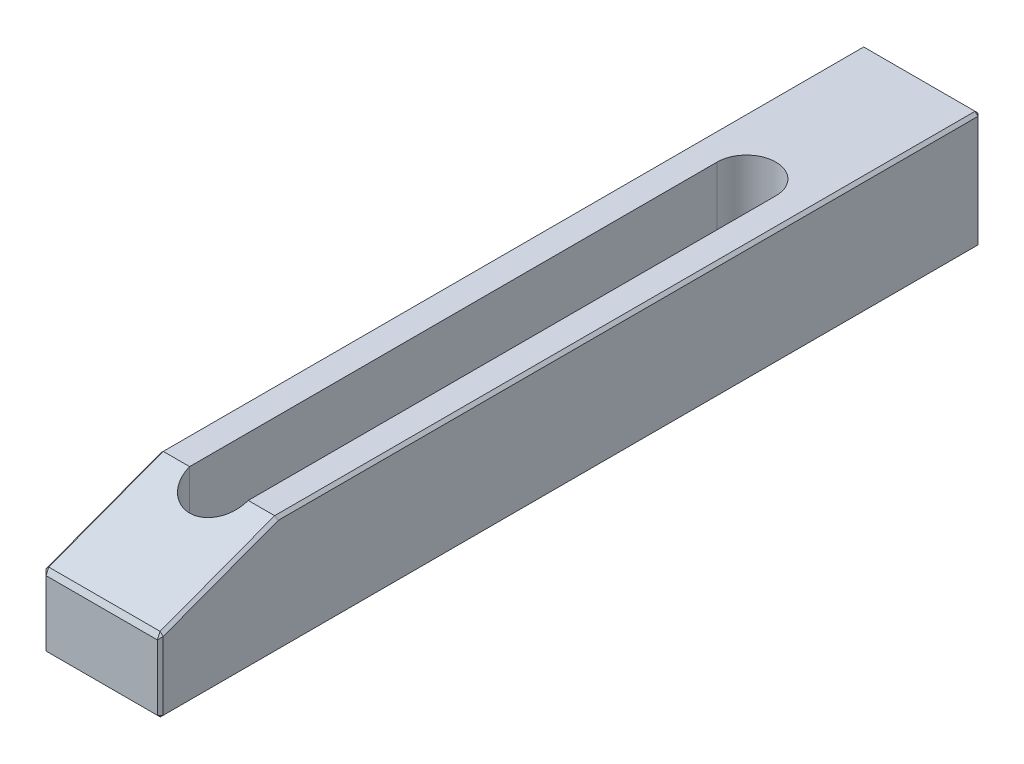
SolidWorks part; units mm, degrees
ref_plane "Plan de face" through (0, 0, 0) normal (0, 0, 1) x (1, 0, 0)
ref_plane "Plan de dessus" through (0, 0, 0) normal (0, 1, 0) x (1, 0, 0)
ref_plane "Plan de droite" through (0, 0, 0) normal (1, 0, 0) x (0, 0, -1)
sketch "Esquisse1" plane through (0, 0, 0) normal (1, 0, 0) x (0, 0, -1)
  line L0 (-280, 25) -> (-240, 40)
  line L1 (0, 0) -> (-280, 0)
  line L2 (0, 0) -> (0, 40)
  line L3 (0, 40) -> (-240, 40)
  line L4 (-280, 0) -> (-280, 25)
  dimension "D1" = 280
  dimension "D2" = 40
  dimension "D3" = 25
  dimension "D4" = 240
extrude "Boss.-Extru.1" add sketch "Esquisse1" along normal mid plane 40
chamfer "Chanfrein1" distance 1 angle 45 14 edges at (0, 25, 280) (20, 12.5, 280) (-20, 12.5, 280) (0, 0, 280) (20, 0, 140) (-20, 0, 140) (0, 0, 0) (20, 20, 0) (0, 40, 0) (-20, 20, 0) (-20, 32.5, 260) (-20, 40, 120) (20, 40, 120) (20, 32.5, 260)
sketch "Esquisse2" plane through (0, 0, 0) normal (0, -1, 0) x (1, 0, 0)
  line L0 (0, 240) -> (0, 60) construction
  line L1 (10, 240) -> (10, 60)
  line L2 (-10, 240) -> (-10, 60)
  line L3 (19, 0) -> (-19, 0) construction
  arc A0 (10, 240) -> (-10, 240) centre (0, 240) ccw
  arc A1 (-10, 60) -> (10, 60) centre (0, 60) ccw
  point P3 (0, 150)
  dimension "D1" = 10
  dimension "D2" = 60
  dimension "D3" = 180
extrude "Enlèv. mat.-Extru.1" cut sketch "Esquisse2" against normal through all
